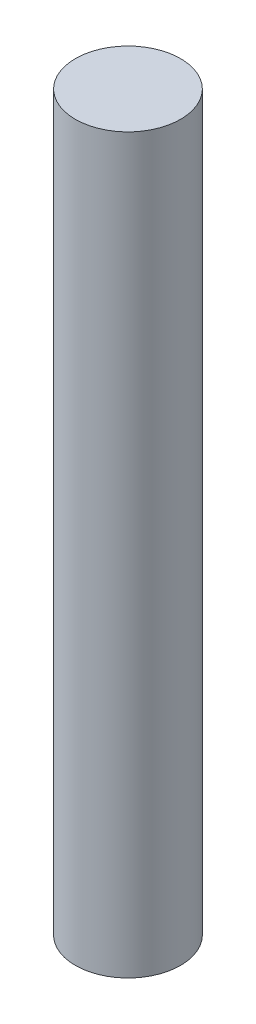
SolidWorks part; units mm, degrees
ref_plane "Front Plane" through (0, 0, 0) normal (0, 0, 1) x (1, 0, 0)
ref_plane "Top Plane" through (0, 0, 0) normal (0, 1, 0) x (1, 0, 0)
ref_plane "Right Plane" through (0, 0, 0) normal (1, 0, 0) x (0, 0, -1)
sketch "Sketch2" plane through (0, 0, 0) normal (0, 1, 0) x (1, 0, 0)
  circle A0 centre (0, 0) radius 9.525
  dimension "D1" = 19.05
extrude "Boss-Extrude1" add sketch "Sketch2" along normal blind 132.6642
